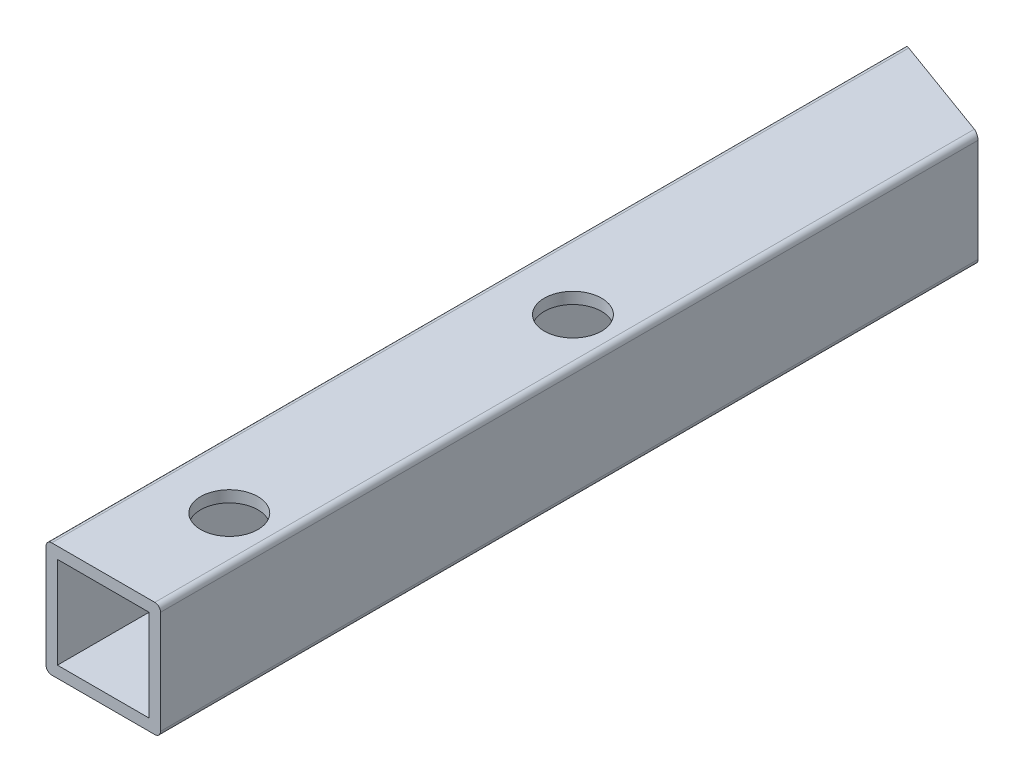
SolidWorks part; units mm, degrees
ref_plane "Plan1" through (0, 0, 0) normal (0, 0, 1) x (1, 0, 0)
ref_plane "Plan2" through (0, 0, 0) normal (0, 1, 0) x (1, 0, 0)
ref_plane "Plan3" through (0, 0, 0) normal (1, 0, 0) x (0, 0, -1)
sketch "Esquisse1" plane through (0, 0, 0) normal (0, 0, 1) x (1, 0, 0)
  line L0 (-9, 10) -> (9, 10)
  line L1 (-10, 9) -> (-10, -9)
  line L2 (9, -10) -> (-9, -10)
  line L3 (10, -9) -> (10, 9)
  line L4 (9, 9) -> (-9, -9) construction
  arc A0 (-9, -10) -> (-10, -9) centre (-9, -9) cw
  arc A1 (-10, 9) -> (-9, 10) centre (-9, 9) cw
  arc A2 (10, 9) -> (9, 10) centre (9, 9) ccw
  arc A3 (10, -9) -> (9, -10) centre (9, -9) cw
  dimension "D1" = 1
  dimension "D2" = 20
extrude "Base-Extru.-Mince" add sketch "Esquisse1" along normal blind 150 thin
ref_plane "Plan7" through (-1.1698, 0, 3.2139) normal (0.342, 0, -0.9397) x (-0.9397, 0, -0.342)
sketch "Esquisse3" plane through (-1.1698, 0, 3.2139) normal (0.342, 0, -0.9397) x (-0.9397, 0, -0.342)
  line L0 (-53, -59) -> (145, -59)
  line L1 (-53, -59) -> (-53, 33)
  line L2 (145, 33) -> (-53, 33)
  line L3 (145, 33) -> (145, -59)
extrude "Enlèv. mat.-Extru.3" cut sketch "Esquisse3" along normal through all
sketch "Esquisse4" plane through (0, 10, 0) normal (0, 1, 0) x (-1, 0, 0)
  line L0 (-10, 150) -> (-10, 7.2794) construction
  line L1 (9, 150) -> (-9, 150) construction
  circle A0 centre (-2, 70) radius 5
  circle A1 centre (-2, 130) radius 5
  dimension "D1" = 10
  dimension "D2" = 60
  dimension "D3" = 8
  dimension "D4" = 20
  dimension "D5" = 70
extrude "Enlèv. mat.-Extru.4" cut sketch "Esquisse4" against normal blind 21
